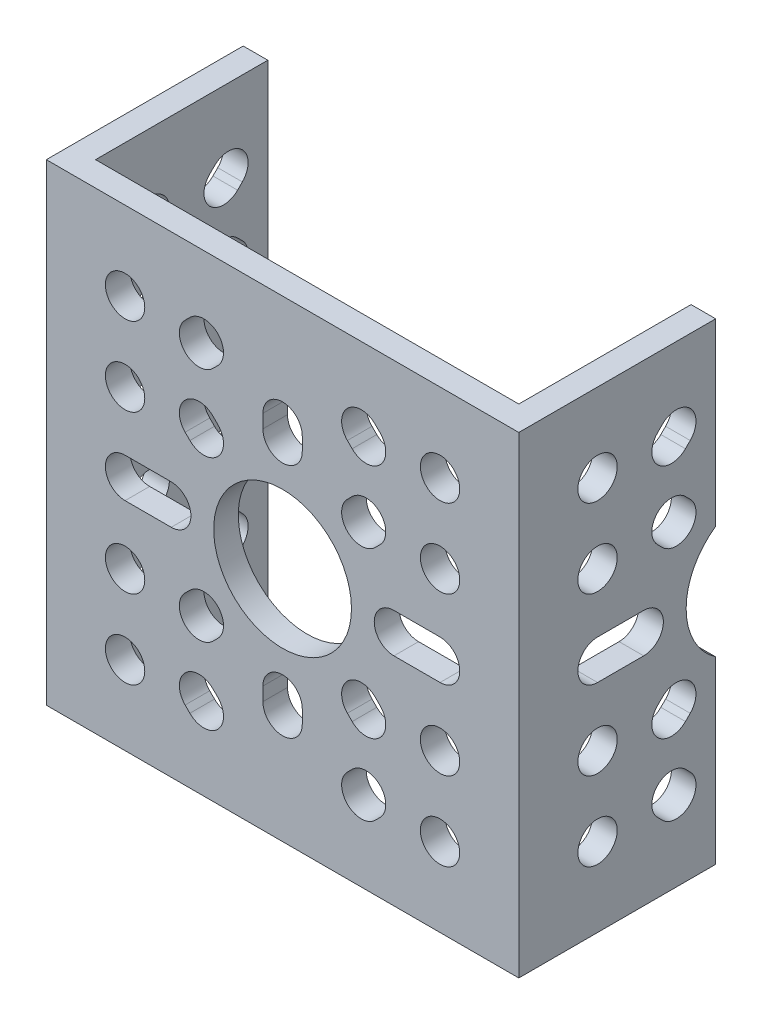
SolidWorks part; units mm, degrees
other "Mirror6"
ref_plane "Front Plane" through (0, 0, 0) normal (0, 0, 1) x (1, 0, 0)
ref_plane "Top Plane" through (0, 0, 0) normal (0, 1, 0) x (1, 0, 0)
ref_plane "Right Plane" through (0, 0, 0) normal (1, 0, 0) x (0, 0, -1)
imported_body "Imported1"
sketch "Sketch2" plane through (24, 0, 0) normal (1, 0, 0) x (0, 0, -1)
  line L0 (45.5, 0) -> (-2.5, 0) construction
  line L1 (45.5, 48) -> (17.5, 48)
  line L2 (45.5, 48) -> (45.5, 0)
  line L3 (45.5, 0) -> (17.5, 0)
  line L4 (17.5, 48) -> (17.5, 0)
  point P7 (13.5, 40)
  dimension "D1" = 4
extrude "Cut-Extrude1" cut sketch "Sketch2" against normal through all
